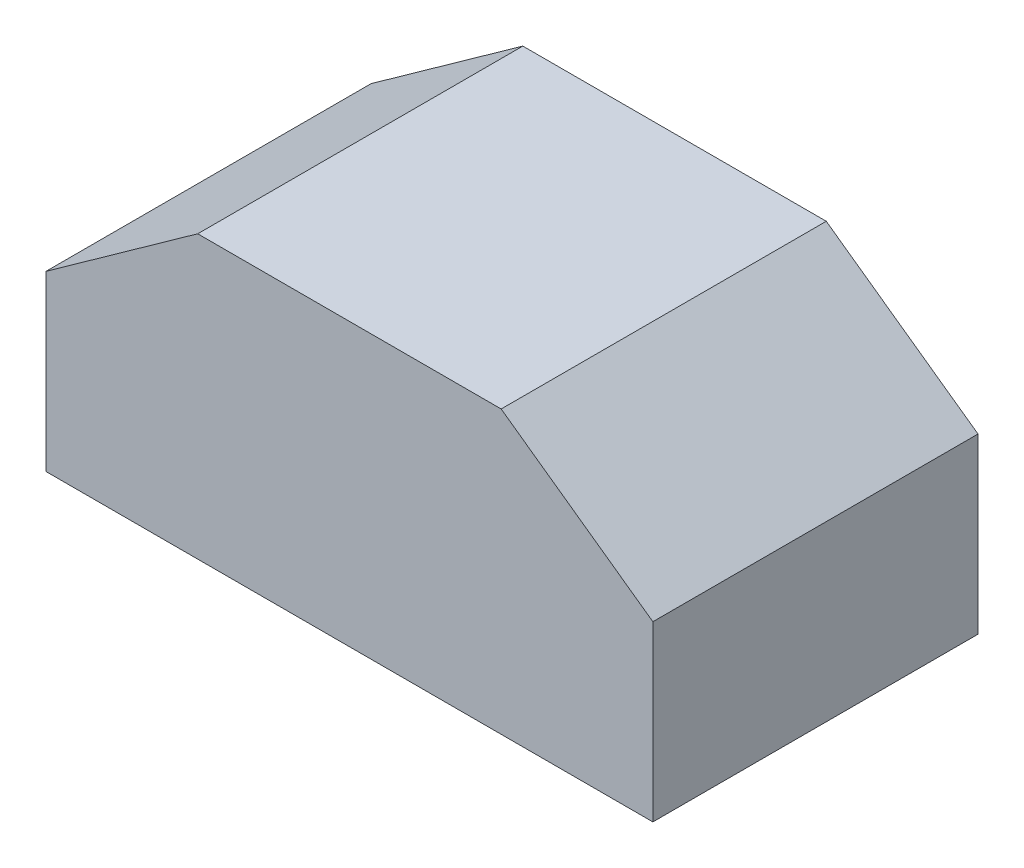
SolidWorks part; units mm, degrees
ref_plane "Plan de face" through (0, 0, 0) normal (0, 0, 1) x (1, 0, 0)
ref_plane "Plan de dessus" through (0, 0, 0) normal (0, 1, 0) x (1, 0, 0)
ref_plane "Plan de droite" through (0, 0, 0) normal (1, 0, 0) x (0, 0, -1)
sketch "Esquisse1" plane through (0, 0, 0) normal (0, 0, 1) x (1, 0, 0)
  line L0 (-70, 0) -> (70, 0)
  line L1 (70, 0) -> (70, 40)
  line L2 (70, 40) -> (35, 65)
  line L3 (35, 65) -> (-35, 65)
  line L4 (-35, 65) -> (-70, 40)
  line L5 (-70, 40) -> (-70, 0)
  dimension "D1" = 65
  dimension "D2" = 140
  dimension "D3" = 70
  dimension "D4" = 40
extrude "Boss.-Extru.1" add sketch "Esquisse1" along normal mid plane 75
